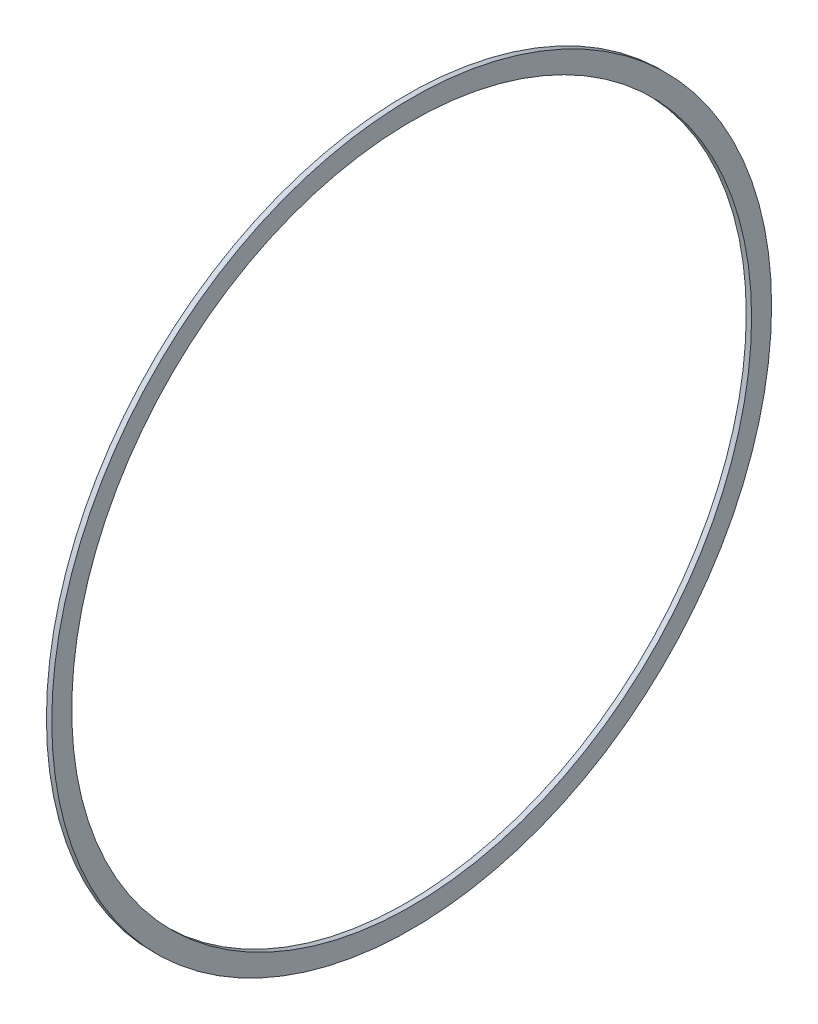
SolidWorks part; units mm, degrees
ref_plane "Спереди" through (0, 0, 0) normal (0, 0, 1) x (1, 0, 0)
ref_plane "Сверху" through (0, 0, 0) normal (0, 1, 0) x (1, 0, 0)
ref_plane "Справа" through (0, 0, 0) normal (1, 0, 0) x (0, 0, -1)
sketch "Эскиз1" plane through (0, 0, 0) normal (0, 0, 1) x (1, 0, 0)
  line L0 (0, 0) -> (0, 135)
  line L1 (0, 135) -> (2, 135)
  line L6 (2, 135) -> (2, 0)
  line L7 (0, 0) -> (47.2859, 0) construction
  line L8 (0, 0) -> (2, 0)
  dimension "D1" = 270
  dimension "D3" = 2
revolve "Повернуть1" add sketch "Эскиз1" angle 360 about L7
sketch "Эскиз2" plane through (2, 0, 0) normal (1, 0, 0) x (0, 0, -1)
  circle A0 centre (0, 0) radius 127.5
  dimension "D1" = 255
extrude "Вырез-Вытянуть1" cut sketch "Эскиз2" against normal through all
